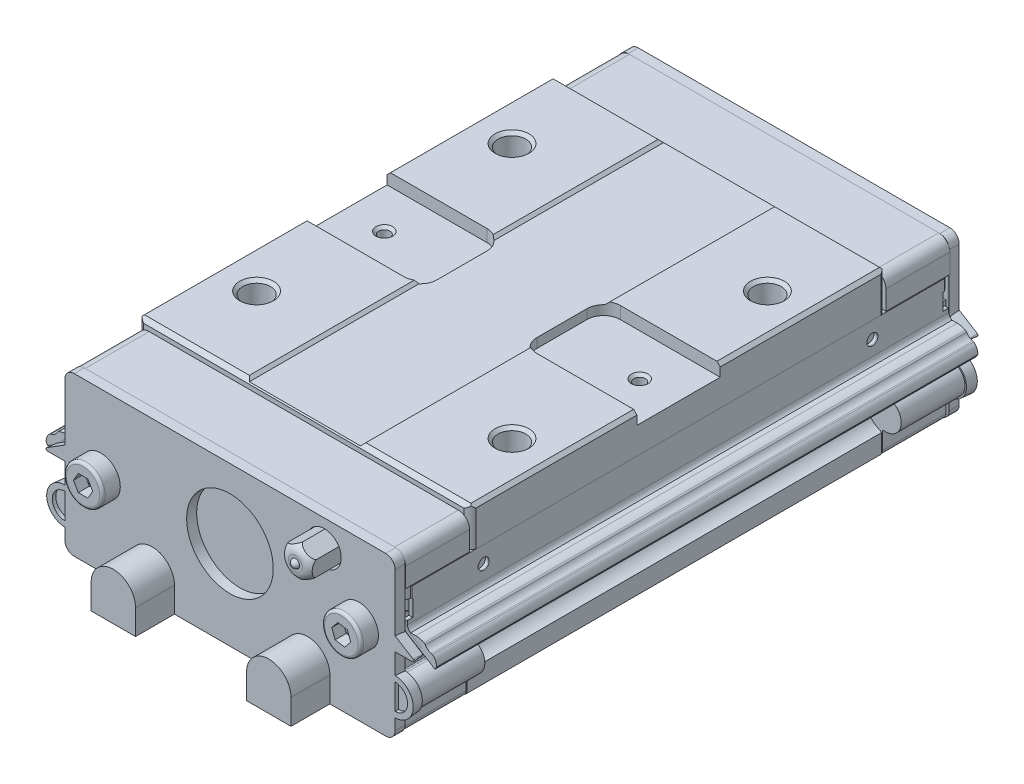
SolidWorks part; units mm, degrees
other "KKR86-FS-P_W-1-solid4"
other "KKR86-FS-P_W-1-solid6"
other "KKR86-FS-P_W-1-solid8"
other "KKR86-FS-P_W-1-solid15"
other "KKR86-FS-P_W-1-solid3"
other "KKR86-FS-P_W-1-solid5"
other "KKR86-FS-P_W-1-solid13"
other "KKR86-FS-P_W-1-solid7"
other "KKR86-FS-P_W-1-solid17"
other "KKR86-FS-P_W-1-solid10"
other "KKR86-FS-P_W-1-solid9"
other "KKR86-FS-P_W-1-solid12"
other "KKR86-FS-P_W-1-solid1"
other "KKR86-FS-P_W-1-solid2"
other "KKR86-FS-P_W-1-solid11"
other "KKR86-FS-P_W-1-solid14"
other "KKR86-FS-P_W-1-solid16"
ref_plane "前视基准面" through (0, 0, 0) normal (0, 0, 1) x (1, 0, 0)
ref_plane "上视基准面" through (0, 0, 0) normal (0, 1, 0) x (1, 0, 0)
ref_plane "右视基准面" through (0, 0, 0) normal (1, 0, 0) x (0, 0, -1)
imported_body "输入2"
imported_body "输入3"
imported_body "输入5"
imported_body "输入6"
imported_body "输入8"
imported_body "输入9"
imported_body "输入11"
imported_body "输入12"
imported_body "输入13"
imported_body "输入14"
imported_body "输入15"
imported_body "输入16"
imported_body "输入18"
imported_body "输入19"
imported_body "输入21"
imported_body "输入22"
imported_body "输入23"
sketch "草图1" plane through (29.85, 0, 0) normal (1, 0, 0) x (0, 0, -1)
  line L0 (-820.2, 7) -> (-831.7032, 7) construction
  line L1 (-828.4769, 9.419) -> (-823.6677, 9.419)
  line L2 (-828.4769, 9.419) -> (-828.4769, 7)
  line L3 (-828.4769, 7) -> (-823.6677, 7)
  line L4 (-823.6677, 9.419) -> (-823.6677, 7)
extrude "切除-拉伸1" cut sketch "草图1" along normal blind 10
sketch "草图2" plane through (-29.85, 0, 0) normal (-1, 0, 0) x (0, 0, 1)
  line L0 (918.2, 10.5) -> (906.6968, 10.5) construction
  line L1 (909.0529, 10.5) -> (914.4794, 10.5)
  line L2 (909.0529, 10.5) -> (909.0529, 7.4422)
  line L3 (909.0529, 7.4422) -> (914.4794, 7.4422)
  line L4 (914.4794, 10.5) -> (914.4794, 7.4422)
extrude "切除-拉伸2" cut sketch "草图2" along normal blind 10
